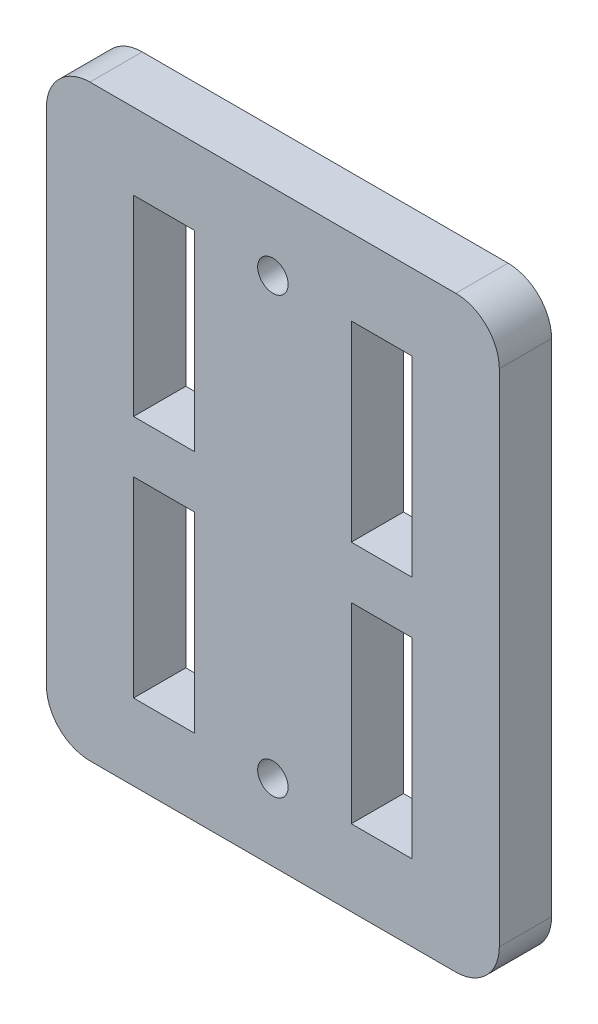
SolidWorks part; units mm, degrees
ref_plane "Спереди" through (0, 0, 0) normal (0, 0, 1) x (1, 0, 0)
ref_plane "Сверху" through (0, 0, 0) normal (0, 1, 0) x (1, 0, 0)
ref_plane "Справа" through (0, 0, 0) normal (1, 0, 0) x (0, 0, -1)
ref_plane "Плоскость1" through (0, 0, -3) normal (0, 0, -1) x (-1, 0, 0)
sketch "Эскиз1" plane through (0, 0, -3) normal (0, 0, -1) x (-1, 0, 0)
  line L0 (-21, -33.75) -> (21, -33.75)
  line L1 (26, -28.75) -> (26, 28.75)
  line L2 (21, 33.75) -> (-21, 33.75)
  line L3 (-26, 28.75) -> (-26, -28.75)
  line L4 (9, 3) -> (9, 25)
  line L5 (9, 25) -> (16, 25)
  line L6 (16, 25) -> (16, 3)
  line L7 (16, 3) -> (9, 3)
  line L8 (-9, 3) -> (-16, 3)
  line L9 (-16, 3) -> (-16, 25)
  line L10 (-16, 25) -> (-9, 25)
  line L11 (-9, 25) -> (-9, 3)
  line L12 (-9, -3) -> (-9, -25)
  line L13 (-9, -25) -> (-16, -25)
  line L14 (-16, -25) -> (-16, -3)
  line L15 (-16, -3) -> (-9, -3)
  line L16 (9, -3) -> (16, -3)
  line L17 (16, -3) -> (16, -25)
  line L18 (16, -25) -> (9, -25)
  line L19 (9, -25) -> (9, -3)
  arc A0 (21, -33.75) -> (26, -28.75) centre (21, -28.75) ccw
  arc A1 (26, 28.75) -> (21, 33.75) centre (21, 28.75) ccw
  arc A2 (-21, 33.75) -> (-26, 28.75) centre (-21, 28.75) ccw
  arc A3 (-26, -28.75) -> (-21, -33.75) centre (-21, -28.75) ccw
  circle A4 centre (0, 25) radius 1.75
  circle A5 centre (0, -25) radius 1.75
extrude "Бобышка-Вытянуть1" add sketch "Эскиз1" against normal blind 6
